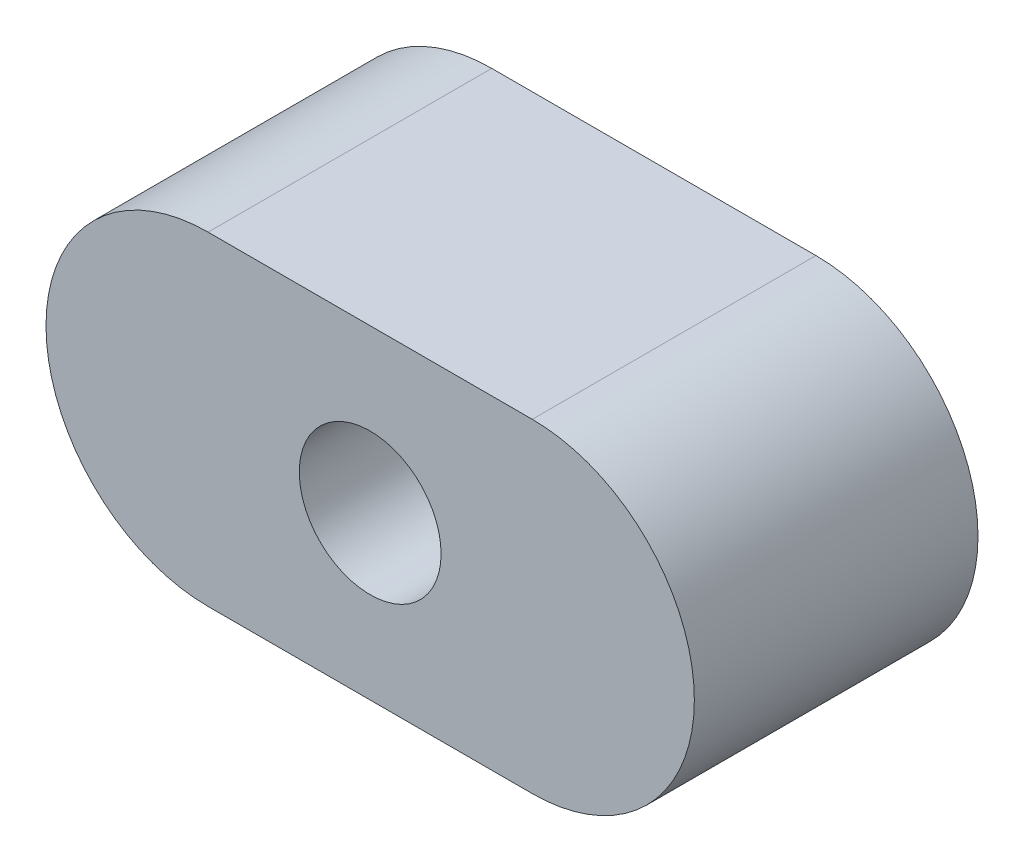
SolidWorks part; units mm, degrees
ref_plane "前视基准面" through (0, 0, 0) normal (0, 0, 1) x (1, 0, 0)
ref_plane "上视基准面" through (0, 0, 0) normal (0, 1, 0) x (1, 0, 0)
ref_plane "右视基准面" through (0, 0, 0) normal (1, 0, 0) x (0, 0, -1)
sketch "草图1" plane through (0, 0, 0) normal (0, 0, 1) x (1, 0, 0)
  line L1 (-4, 4) -> (4, 4)
  line L3 (-4, -4) -> (4, -4)
  circle A0 centre (0, 0) radius 1.75
  arc A1 (4, 4) -> (4, -4) centre (4, 0) cw
  arc A2 (-4, 4) -> (-4, -4) centre (-4, 0) ccw
  dimension "D1" = 4
  dimension "D3" = 3.5
  dimension "D2" = 8
extrude "拉伸1" add sketch "草图1" along normal blind 7
